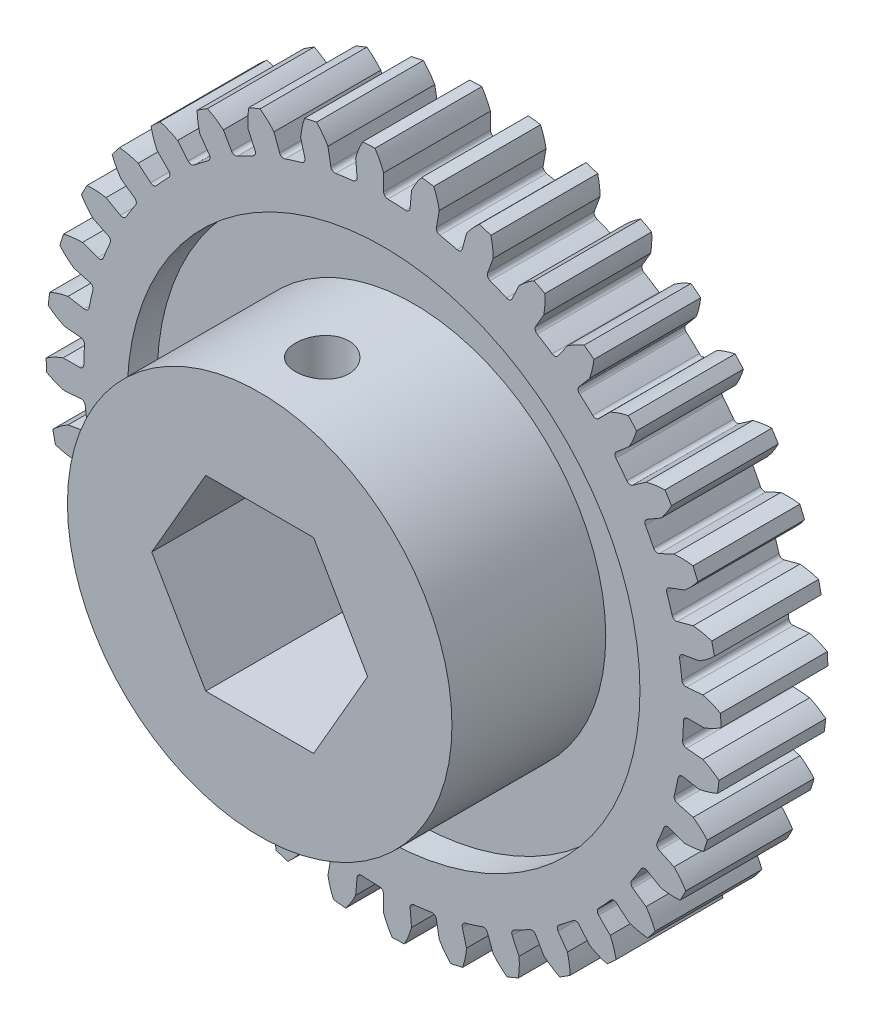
SolidWorks part; units mm, degrees
ref_plane "Front Plane" through (0, 0, 0) normal (0, 0, 1) x (1, 0, 0)
ref_plane "Top Plane" through (0, 0, 0) normal (0, 1, 0) x (1, 0, 0)
ref_plane "Right Plane" through (0, 0, 0) normal (1, 0, 0) x (0, 0, -1)
imported_body "Imported1"
sketch "Sketch1" plane through (0, 0, -9.9486) normal (0, 0, 1) x (1, 0, 0)
  line L6 (187.7734, 133.7854) -> (181.3575, 133.7854)
  line L7 (181.3575, 133.7854) -> (178.1496, 128.2291)
  line L8 (178.1496, 128.2291) -> (181.3575, 122.6729)
  line L9 (181.3575, 122.6729) -> (187.7734, 122.6729)
  line L10 (187.7734, 122.6729) -> (190.9813, 128.2291)
  line L11 (190.9813, 128.2291) -> (187.7734, 133.7854)
  line L12 (187.7734, 133.7854) -> (181.3575, 133.7854)
  line L13 (181.3575, 133.7854) -> (178.1496, 128.2291)
  line L14 (178.1496, 128.2291) -> (181.3575, 122.6729)
  line L15 (181.3575, 122.6729) -> (187.7734, 122.6729)
  line L16 (187.7734, 122.6729) -> (190.9813, 128.2291)
  line L17 (190.9813, 128.2291) -> (187.7734, 133.7854)
  dimension "D1" = 0
extrude "Cut-Extrude1" cut sketch "Sketch1" against normal through all
